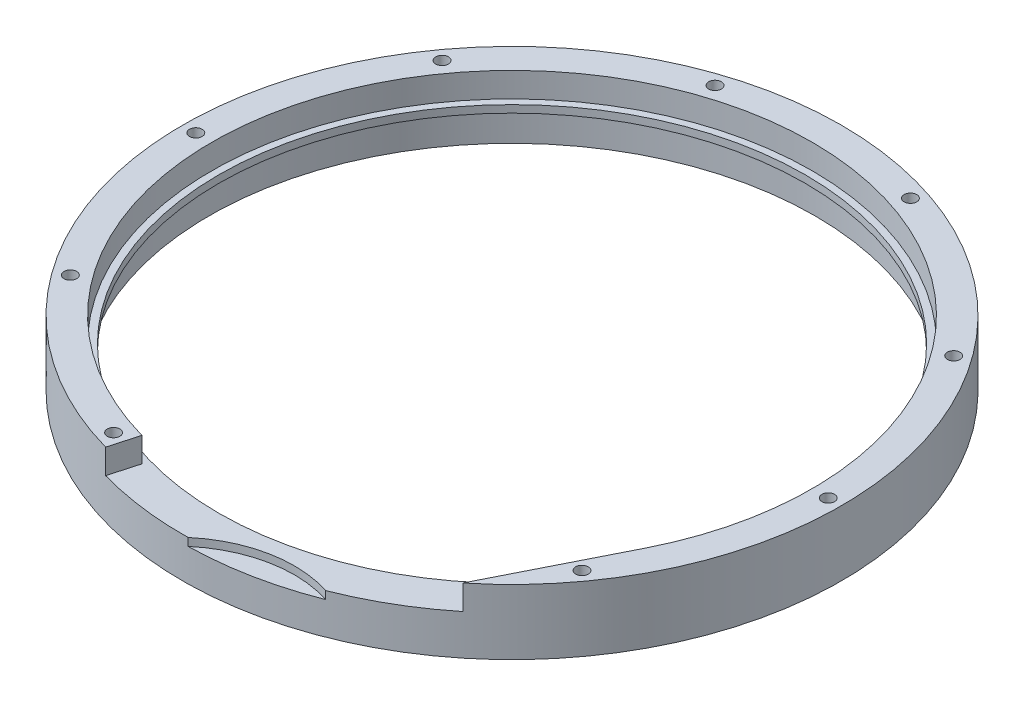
SolidWorks part; units mm, degrees
ref_plane "Front" through (0, 0, 0) normal (0, 0, 1) x (1, 0, 0)
ref_plane "Top" through (0, 0, 0) normal (0, 1, 0) x (1, 0, 0)
ref_plane "Right" through (0, 0, 0) normal (1, 0, 0) x (0, 0, -1)
sketch "Sketch1" plane through (0, 0, 0) normal (0, 0, 1) x (1, 0, 0)
  line L1 (84.858, 0) -> (84.858, -19.701)
  line L2 (84.858, -19.701) -> (75.5, -19.701)
  line L3 (75.5, -19.701) -> (75.5, -16.272)
  line L4 (75.5, -16.272) -> (78, -16.272)
  line L5 (78, -16.272) -> (78, -8.272)
  line L6 (78, -8.272) -> (75.5, -8.272)
  line L7 (75.5, -8.272) -> (75.5, 0)
  line L8 (75.5, 0) -> (84.858, 0)
  line L9 (0, 0) -> (0, -17.7605) construction
  dimension "D1" = 156
  dimension "D2" = 151
  dimension "D3" = 8
  dimension "D4" = 8.272
  dimension "D5" = 3.429
  dimension "D6" = 6.858
revolve "Revolve1" add sketch "Sketch1" angle 360 about L9
ref_plane "Plane2" through (0, -16.772, 0) normal (0, -1, 0) x (1, 0, 0)
sketch "Sketch2" plane through (0, -16.772, 0) normal (0, -1, 0) x (1, 0, 0)
  circle A0 centre (0, 0) radius 126.3631
extrude "Cut-Extrude1" cut sketch "Sketch2" along normal through all
sketch "Sketch6" plane through (0, 0, 0) normal (0, 0, 1) x (1, 0, 0)
  line L0 (0, 0) -> (0, -24.7982) construction
  line L1 (78, -16.272) -> (78, -8.272) construction
  line L2 (75.5, -6.367) -> (77.2888, -6.367)
  line L3 (75.5, -6.367) -> (75.5, 0)
  line L4 (75.5, 0) -> (77.2888, 0)
  line L5 (77.2888, -6.367) -> (77.2888, 0)
  line L7 (84.858, 0) -> (-84.858, 0) construction
  line L8 (75.5, -8.272) -> (75.5, 0) construction
  line L9 (-78, -8.272) -> (78, -8.272) construction
  dimension "D1" = 0.7112
  dimension "D2" = 1.905
revolve "Cut-Revolve1" cut sketch "Sketch6" angle 360 about L0
sketch "Sketch7" plane through (0, -16.772, 0) normal (0, -1, 0) x (1, 0, 0)
  circle A0 centre (0, 0) radius 78
  circle A2 centre (0, 0) radius 78 construction
extrude "Cut-Extrude3" cut sketch "Sketch7" against normal up to next
sketch "Sketch3" plane through (0, 0, 0) normal (0, 1, 0) x (-1, 0, 0)
  line L0 (-53.33, 66.006) -> (-69.0599, 34.7028)
  line L1 (0, 0) -> (-69.0599, 34.7028) construction
  line L2 (-69.0599, 34.7028) -> (0, 0)
  line L3 (0, 0) -> (22.9626, 81.6921)
  line L4 (23.0666, 82.0622) -> (21.1009, 75.0688) construction
  line L6 (-29.9723, 112.6669) -> (-69.1314, 34.7387) construction
  arc A0 (22.9626, 81.6921) -> (-53.33, 66.006) centre (0, 0) ccw
  circle A1 centre (0, 0) radius 84.858 construction
  circle A5 centre (0, 0) radius 77.2888 construction
extrude "Cut-Extrude2" cut sketch "Sketch3" against normal up to surface (6.367 mm away)
sketch "Sketch8" plane through (0, -6.367, 0) normal (0, 1, 0) x (-1, 0, 0)
  line L0 (-13.1028, 89.7486) -> (-8.8165, 80.1962) construction
  line L1 (-21.4695, 108.3942) -> (-13.1028, 89.7486) construction
  circle A0 centre (-21.4695, 108.3942) radius 30.9068
  arc A3 (-44.4029, 92.4349) -> (-29.7529, 81.7104) centre (-21.4695, 108.3942) ccw construction
  circle A6 centre (-13.1028, 89.7486) radius 9.2 construction
  point P7 (-9.3365, 81.3549)
  point P9 (-13.1028, 89.7486)
  dimension "D1" = 1.27
extrude "Cut-Extrude4" cut sketch "Sketch8" against normal blind 2
hole_wizard "#30 (0.1285) Diameter Hole1" positions "Sketch5" profile "Sketch4" hole size "#30" standard "Ansi Inch"
sketch "Sketch5" plane through (0, -16.772, 0) normal (0, -1, 0) x (1, 0, 0)
  line L0 (84.858, 0) -> (78, 0) construction
  line L2 (0, 0) -> (113.1877, 0) construction
  circle A2 centre (0, 0) radius 84.858 construction
  circle A3 centre (0, 0) radius 78 construction
  point P0 (81.429, 0)
sketch "Sketch4" plane through (81.429, -16.772, 0) normal (1, 0, 0) x (0, 0, -1)
  line L0 (0, 0) -> (0, 16.772)
  line L1 (0, 16.772) -> (1.6319, 16.772)
  line L2 (1.6319, 16.772) -> (1.6319, 0)
  line L5 (1.6319, 0) -> (0, 0)
  line L11 (0, -6.35) -> (0, 107.95) construction
  dimension "Thru Hole Dia." = 3.2639
  dimension "Thru Hole Depth" = 16.772
pattern_circular "CirPattern1" count 10 over 360 about axis through (0, 0, 0) along (0, 1, 0) of "#30 (0.1285) Diameter Hole1"
